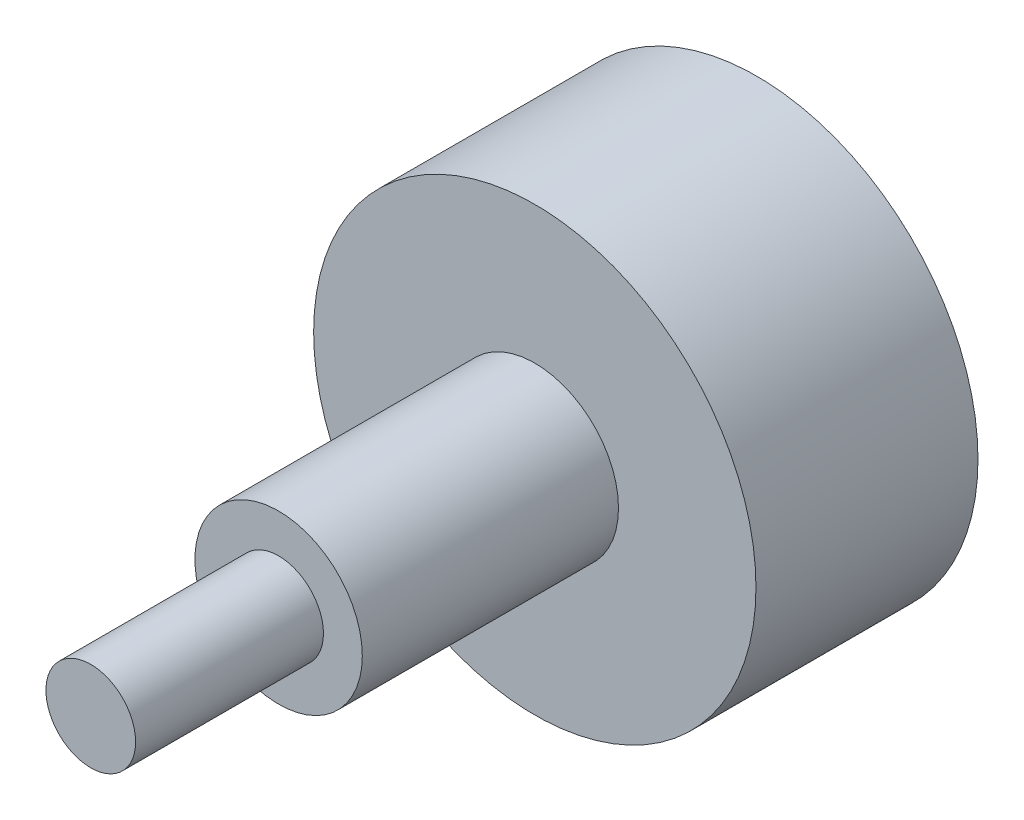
SolidWorks part; units mm, degrees
ref_plane "Front Plane" through (0, 0, 0) normal (0, 0, 1) x (1, 0, 0)
ref_plane "Top Plane" through (0, 0, 0) normal (0, 1, 0) x (1, 0, 0)
ref_plane "Right Plane" through (0, 0, 0) normal (1, 0, 0) x (0, 0, -1)
sketch "Sketch2" plane through (0, 0, 0) normal (0, 0, 1) x (1, 0, 0)
  circle A0 centre (0, 0) radius 12.5
  dimension "D1" = 25
extrude "Boss-Extrude1" add sketch "Sketch2" along normal blind 13
sketch "Sketch3" plane through (0, 0, 13) normal (0, 0, 1) x (1, 0, 0)
  circle A0 centre (0, 0) radius 2.45
  dimension "D1" = 4.9
extrude "Boss-Extrude2" add sketch "Sketch3" along normal blind 26
sketch "Sketch4" plane through (0, 0, 0) normal (0, 0, -1) x (-1, 0, 0)
  circle A0 centre (0, 0) radius 12.9
  dimension "D1" = 25.8
extrude "Boss-Extrude3" add sketch "Sketch4" against normal up to surface (13 mm away)
sketch "Sketch5" plane through (0, 0, 39) normal (0, 0, 1) x (1, 0, 0)
  circle A0 centre (0, 0) radius 2.625
  dimension "D1" = 5.25
extrude "Boss-Extrude4" add sketch "Sketch5" against normal up to surface (26 mm away)
sketch "Sketch6" plane through (0, 0, 13) normal (0, 0, 1) x (1, 0, 0)
  circle A0 centre (0, 0) radius 4.9
  dimension "D1" = 9.8
extrude "Boss-Extrude5" add sketch "Sketch6" along normal blind 15
sketch "Sketch7" plane through (0, 0, 0) normal (0, 0, -1) x (-1, 0, 0)
  circle A0 centre (0, 0) radius 13.125
  dimension "D1" = 26.25
extrude "Boss-Extrude6" add sketch "Sketch7" against normal up to surface (13 mm away)
sketch "Sketch8" plane through (0, 0, 0) normal (0, 0, -1) x (-1, 0, 0)
  circle A0 centre (0, 0) radius 12.95
  circle A1 centre (0, 0) radius 13.125
  dimension "D1" = 25.9
extrude "Cut-Extrude1" cut sketch "Sketch8" against normal through all
